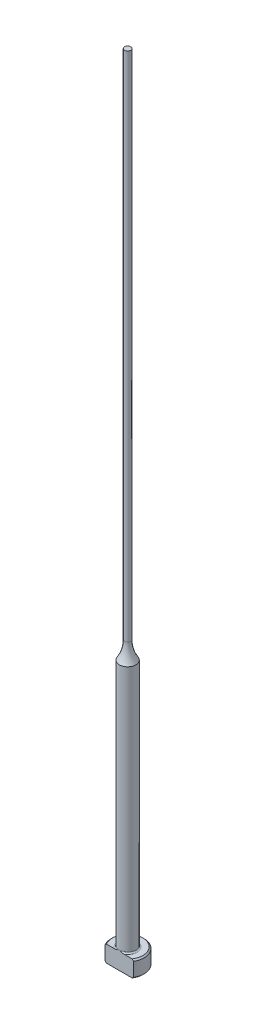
SolidWorks part; units mm, degrees
ref_plane "Front Plane" through (0, 0, 0) normal (0, 0, 1) x (1, 0, 0)
ref_plane "Top Plane" through (0, 0, 0) normal (0, 1, 0) x (1, 0, 0)
ref_plane "Right Plane" through (0, 0, 0) normal (1, 0, 0) x (0, 0, -1)
sketch "Sketch1" plane through (0, 0, 0) normal (0, 0, 1) x (1, 0, 0)
  line L0 (0, 259.9588) -> (0, -15.1925) construction
  line L1 (0, 0) -> (-3.175, 0)
  line L2 (-3.175, 0) -> (-3.175, 3.175)
  line L3 (-3.175, 3.175) -> (-1.5875, 3.175)
  line L4 (-0.5944, 54.2098) -> (-0.5944, 152.4)
  line L5 (-0.5944, 152.4) -> (0, 152.4)
  line L6 (0, 152.4) -> (0, 0)
  line L7 (-1.5875, 3.175) -> (-1.5875, 50.8)
  arc A0 (-1.5875, 50.8) -> (-0.5944, 54.2098) centre (-6.9444, 54.2098) ccw
  point P13 (-1.5875, 0)
  dimension "D1" = 6.35
  dimension "L" = 152.4
  dimension "D2" = 3.175
  dimension "H" = 6.35
  dimension "T" = 3.175
  dimension "D" = 1.1887
  dimension "S" = 50.8
revolve "Revolve1" add sketch "Sketch1" angle 360 about L0
chamfer "Chamfer1" distance 0.254 angle 45 2 edges at (0, 3.175, 3.175) (0, 0, 3.175)
fillet "Fillet1" radius 0.254 1 edges at (0, 3.175, 1.5875)
sketch "Sketch2" plane through (0, 0, 0) normal (0, -1, 0) x (1, 0, 0)
  line L0 (-2.7496, 1.5875) -> (2.7496, 1.5875)
  circle A0 centre (0, 0) radius 3.175 construction
  arc A1 (2.7496, 1.5875) -> (-2.7496, 1.5875) centre (0, 0) ccw
  circle A4 centre (0, 0) radius 1.5875 construction
  dimension "D1" = 0
extrude "KEY" cut sketch "Sketch2" against normal through all
